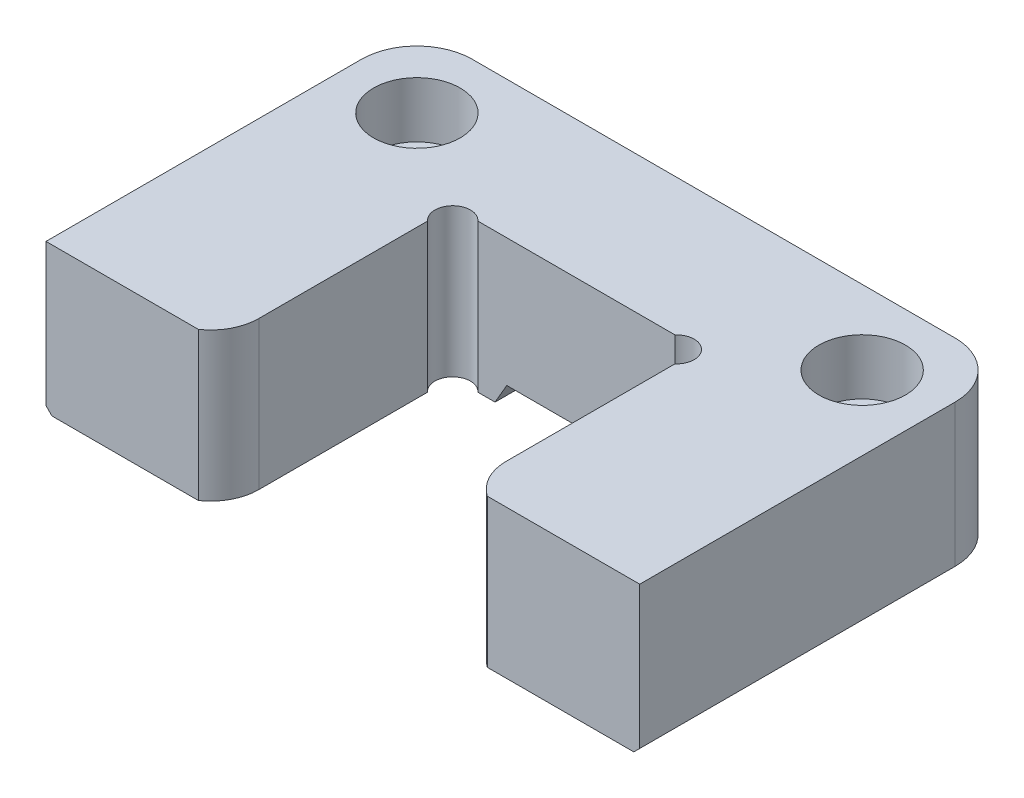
SolidWorks part; units mm, degrees
ref_plane "Front Plane" through (0, 0, 0) normal (0, 0, 1) x (1, 0, 0)
ref_plane "Top Plane" through (0, 0, 0) normal (0, 1, 0) x (1, 0, 0)
ref_plane "Right Plane" through (0, 0, 0) normal (1, 0, 0) x (0, 0, -1)
sketch "Sketch1" plane through (0, 0, 0) normal (0, 1, 0) x (1, 0, 0)
  line L0 (0, 0) -> (0, 50000) construction
  line L1 (0, 0) -> (50000, 0) construction
  line L2 (15.875, 0) -> (38.1, 0)
  line L3 (-38.1, 0) -> (-15.875, 0)
  line L4 (-38.1, 0) -> (-38.1, 47.5996)
  line L5 (-38.1, 47.5996) -> (38.1, 47.5996)
  line L6 (38.1, 0) -> (38.1, 47.5996)
  line L8 (-15.875, 0) -> (-15.875, 29.972)
  line L9 (-15.875, 29.972) -> (15.875, 29.972)
  line L10 (15.875, 0) -> (15.875, 29.972)
  dimension "D1" = 47.5996
  dimension "D2" = 76.2
  dimension "D3" = 31.75
  dimension "D4" = 29.972
extrude "Boss-Extrude1" add sketch "Sketch1" against normal blind 19.0246 separate body
fillet "Fillet1" radius 7.112 2 edges at (38.1, -9.5123, -47.5996) (-38.1, -9.5123, -47.5996)
sketch "Sketch2" plane through (0, 0, 0) normal (0, 1, 0) x (1, 0, 0)
  line L0 (0, 0) -> (0, 50000) construction
  line L1 (-15.875, 0) -> (-15.875, 29.972) construction
  line L2 (-38.1, 0) -> (-15.875, 0) construction
  line L3 (-15.875, 5.08) -> (-15.875, 12.7)
  line L4 (-28.575, 0) -> (-18.5428, 0)
  line L5 (28.575, 0) -> (28.575, -12.7)
  line L6 (-28.575, -12.7) -> (28.575, -12.7)
  line L7 (-15.875, 12.7) -> (15.875, 12.7)
  line L8 (-28.575, 0) -> (-28.575, -12.7)
  line L9 (28.575, 0) -> (18.5428, 0)
  line L10 (15.875, 5.08) -> (15.875, 12.7)
  arc A0 (-16.3406, 1.6727) -> (-18.5428, 0) centre (-18.5428, 2.286) cw construction
  arc A1 (16.3406, 1.6727) -> (15.875, 5.08) centre (28.575, 5.08) cw construction
  arc A2 (-16.3406, 1.6727) -> (-15.875, 5.08) centre (-28.575, 5.08) ccw construction
  arc A3 (16.3406, 1.6727) -> (18.5428, 0) centre (18.5428, 2.286) ccw construction
  arc A4 (18.5428, 0) -> (15.875, 5.08) centre (22.0455, 5.08) cw
  arc A5 (-18.5428, 0) -> (-15.875, 5.08) centre (-22.0455, 5.08) ccw
  point P14 (0, -12.7)
  point P24 (0, 12.7)
  dimension "D1" = 2.286
  dimension "D2" = 12.7
  dimension "D3" = 5.08
  dimension "D4" = 12.7
  dimension "D5" = 12.7
extrude "Cut-Extrude1" cut sketch "Sketch2" against normal through all
sketch "Sketch3" plane through (0, 0, 0) normal (0, 1, 0) x (1, 0, 0)
  line L2 (-16.637, 5.08) -> (-16.637, 29.972)
  line L3 (-16.637, 5.08) -> (-16.637, 29.972) construction
  line L4 (0, 0) -> (0, 50000) construction
  line L5 (-15.875, 30.734) -> (15.875, 30.734)
  line L6 (-15.875, 30.734) -> (15.875, 30.734) construction
  circle A0 centre (-14.351, 28.448) radius 2.286
  circle A1 centre (14.351, 28.448) radius 2.286
  dimension "D3" = 2.286
  dimension "D1" = 0.762
  dimension "D2" = 0.762
extrude "Cut-Extrude2" cut sketch "Sketch3" against normal through all
sketch "Sketch5" plane through (0, 0, -47.5996) normal (0, 0, -1) x (-1, 0, 0)
  line L0 (-9.525, -17.4371) -> (9.525, -17.4371)
  line L1 (-30.988, 0) -> (30.988, 0) construction
  line L2 (0, 0) -> (0, 50000) construction
  line L3 (9.525, -17.4371) -> (10.4415, -19.0246)
  line L4 (-30.988, -19.0246) -> (30.988, -19.0246) construction
  line L5 (-10.4415, -19.0246) -> (10.4415, -19.0246)
  line L6 (-9.525, -17.4371) -> (-10.4415, -19.0246)
  point P4 (0, 0)
  point P12 (0, -19.0246)
  point P13 (0, -17.4371)
  dimension "D1" = 30
  dimension "D2" = 1.5875
  dimension "D3" = 19.05
extrude "Cut-Extrude3" cut sketch "Sketch5" against normal through all
chamfer "Chamfer1" distance 0.762 angle 45 6 edges at (20.7148, -19.0246, -47.5996) (36.0169, -19.0246, -45.5165) (38.1, -19.0246, -20.2438) (-20.7148, -19.0246, -47.5996) (-36.0169, -19.0246, -45.5165) (-38.1, -19.0246, -20.2438)
chamfer "Chamfer5" distance 3.81 angle 15 1 edges at (0, -17.4371, -29.972)
hole_wizard "1/4\" CBORE" positions "Sketch7" profile "Sketch6" counterbore size "1/4" standard "Ansi Inch"
sketch "Sketch7" plane through (9.0831, 0, -5.226) normal (0, 1, 0) x (-1, 0, 0)
  line L0 (9.0831, 0) -> (9.0831, 50000) construction
  line L1 (-21.9049, -42.3736) -> (40.0711, -42.3736) construction
  line L2 (47.1831, -35.2616) -> (47.1831, 5.226) construction
  point P0 (37.6581, -32.8486)
  point P11 (-19.4919, -32.8486)
  dimension "D1" = 9.525
  dimension "D2" = 9.525
sketch "Sketch6" plane through (-28.575, 0, -38.0746) normal (1, 0, 0) x (0, 0, 1)
  line L0 (0, 0) -> (0, 19.0246)
  line L1 (0, 19.0246) -> (3.2639, 19.0246)
  line L3 (3.2639, 19.0246) -> (3.2639, 7.1437)
  line L4 (3.2639, 7.1437) -> (5.5562, 7.1437)
  line L5 (5.5562, 7.1437) -> (5.5562, 0)
  line L7 (5.5562, 0) -> (0, 0)
  line L11 (0, -6.35) -> (0, 107.95) construction
  dimension "Thru Hole Dia." = 6.5278
  dimension "Thru Hole Depth" = 19.0246
  dimension "C'Bore Dia." = 11.1125
  dimension "C'Bore Depth" = 7.1437
